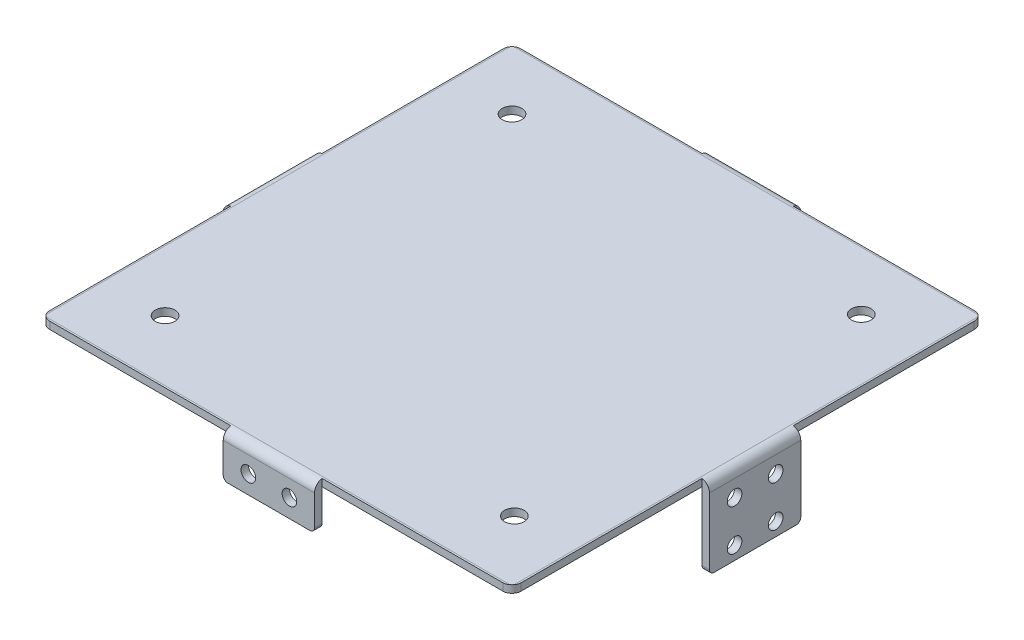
SolidWorks part; units mm, degrees
ref_plane "Front Plane" through (0, 0, 0) normal (0, 0, 1) x (1, 0, 0)
ref_plane "Top Plane" through (0, 0, 0) normal (0, 1, 0) x (1, 0, 0)
ref_plane "Right Plane" through (0, 0, 0) normal (1, 0, 0) x (0, 0, -1)
sketch "Sketch1" plane through (0, 0, 0) normal (0, 1, 0) x (1, 0, 0)
  line L1 (-51.63, -51.63) -> (51.63, -51.63)
  line L2 (-51.63, -51.63) -> (-51.63, 51.63)
  line L3 (-51.63, 51.63) -> (51.63, 51.63)
  line L4 (51.63, -51.63) -> (51.63, 51.63)
  line L5 (-51.63, -51.63) -> (51.63, 51.63) construction
  line L6 (-51.63, 51.63) -> (51.63, -51.63) construction
  point P0 (0, 0)
  dimension "D1" = 103.26
extrude "Boss-Extrude1" add sketch "Sketch1" along normal blind 1.63 contours L2 L1 L4 L3
sketch "Sketch2" plane through (0, 1.63, 0) normal (0, 1, 0) x (1, 0, 0)
  line L0 (-51.63, 51.63) -> (51.63, 51.63) construction
  line L1 (-10, 51.63) -> (10, 51.63)
  line L2 (-10, 51.63) -> (-10, 53.26)
  line L3 (-10, 53.26) -> (10, 53.26)
  line L4 (10, 51.63) -> (10, 53.26)
  line L5 (-51.63, -51.63) -> (-51.63, 51.63) construction
  line L6 (-51.63, 0) -> (51.63, 0) construction
  line L7 (51.63, -51.63) -> (51.63, 51.63) construction
  line L8 (-10, -53.26) -> (10, -53.26)
  line L9 (10, -51.63) -> (10, -53.26)
  line L10 (-10, -51.63) -> (10, -51.63)
  line L11 (-10, -51.63) -> (-10, -53.26)
  point P13 (0, 0)
  dimension "D1" = 20
  dimension "D2" = 41.63
  dimension "D3" = 1.63
sketch "Sketch3" plane through (0, 1.63, 0) normal (0, 1, 0) x (1, 0, 0)
  line L0 (0, 51.63) -> (0, -51.63) construction
  line L3 (51.63, -51.63) -> (51.63, 51.63) construction
  line L4 (51.63, -10) -> (53.26, -10)
  line L5 (51.63, -10) -> (51.63, 10)
  line L6 (51.63, 10) -> (53.26, 10)
  line L7 (53.26, -10) -> (53.26, 10)
  line L8 (-51.63, 51.63) -> (51.63, 51.63) construction
  line L9 (-51.63, -51.63) -> (51.63, -51.63) construction
  line L11 (-51.63, 10) -> (-53.26, 10)
  line L12 (-53.26, -10) -> (-53.26, 10)
  line L13 (-51.63, -10) -> (-53.26, -10)
  line L14 (-51.63, -10) -> (-51.63, 10)
  dimension "D1" = 20
  dimension "D2" = 41.63
  dimension "D3" = 1.63
extrude "Boss-Extrude2" add sketch "Sketch2" against normal blind 9.63
extrude "Boss-Extrude3" add sketch "Sketch3" against normal blind 17.58
sketch "Sketch4" plane through (0, 0, 53.26) normal (0, 0, 1) x (1, 0, 0)
  line L0 (0, 1.63) -> (0, -8) construction
  line L1 (-10, 1.63) -> (10, 1.63) construction
  line L2 (-10, -8) -> (10, -8) construction
  line L3 (-51.63, 0) -> (-10, 0) construction
  circle A0 centre (-4.5, -4) radius 1.6
  circle A1 centre (4.5, -4) radius 1.6
  dimension "D1" = 3.2
  dimension "D2" = 4.5
  dimension "D3" = 4
extrude "Cut-Extrude1" cut sketch "Sketch4" against normal through all
sketch "Sketch5" plane through (53.26, 0, 0) normal (1, 0, 0) x (0, 0, -1)
  line L1 (-10, -15.95) -> (-10, 1.63) construction
  line L2 (0, 1.63) -> (0, -15.95) construction
  line L3 (-10, 1.63) -> (10, 1.63) construction
  line L4 (-10, -15.95) -> (10, -15.95) construction
  line L5 (10, -8.5) -> (-10, -8.5) construction
  line L6 (10, -15.95) -> (10, 1.63) construction
  circle A0 centre (-4.5, -4) radius 1.6
  circle A1 centre (4.5, -4) radius 1.6
  circle A2 centre (4.5, -13) radius 1.6
  circle A3 centre (-4.5, -13) radius 1.6
  dimension "D1" = 3.2
  dimension "D2" = 4.5
  dimension "D3" = 4.5
  dimension "D4" = 7.45
extrude "Cut-Extrude2" cut sketch "Sketch5" against normal through all
fillet "Fillet1" radius 1 8 edges at (-10, -8, -52.445) (10, -8, -52.445) (10, -8, 52.445) (-10, -8, 52.445) (52.445, -15.95, 10) (52.445, -15.95, -10) (-52.445, -15.95, -10) (-52.445, -15.95, 10)
fillet "Fillet2" radius 2 4 edges at (53.26, 1.63, 0) (0, 1.63, -53.26) (0, 1.63, 53.26) (-53.26, 1.63, 0)
fillet "Fillet3" radius 2 4 edges at (51.63, 0.7977, -51.63) (51.63, 0.7977, 51.63) (-51.63, 0.7977, 51.63) (-51.63, 0.7977, -51.63)
sketch "Sketch6" plane through (0, 1.63, 0) normal (0, 1, 0) x (1, 0, 0)
  line L0 (50.7889, 51.26) -> (-50.7889, 51.26) construction
  line L2 (-51.26, 50.7889) -> (-51.26, -50.7889) construction
  circle A0 centre (-38.26, 38.26) radius 2.15
  circle A2 centre (38, 38.52) radius 2.15
  circle A3 centre (38.26, -37.74) radius 2.15
  circle A4 centre (-38, -38) radius 2.15
  circle A5 centre (-38.26, 38.26) radius 6
  circle A6 centre (38, 38.52) radius 6
  circle A7 centre (38.26, -37.74) radius 6
  circle A8 centre (-38, -38) radius 6
  point P15 (0, 0.26)
  point P23 (0, 0.26)
extrude "Cut-Extrude4" cut sketch "Sketch6" against normal through all and the other way through all contours A0 | A2 | A3 | A4
sketch "Sketch7" plane through (0, 0, 0) normal (0, -1, 0) x (1, 0, 0)
  circle A0 centre (-38.26, -38.26) radius 6 construction
  circle A1 centre (38, -38.52) radius 6 construction
  circle A2 centre (38.26, 37.74) radius 6 construction
  circle A3 centre (-38, 38) radius 6 construction
  circle A4 centre (-38.26, -38.26) radius 6
  circle A5 centre (38, -38.52) radius 6
  circle A6 centre (38.26, 37.74) radius 6
  circle A7 centre (-38, 38) radius 6
equation "\"D3@Sketch6\"=\"D2@Sketch6\""
